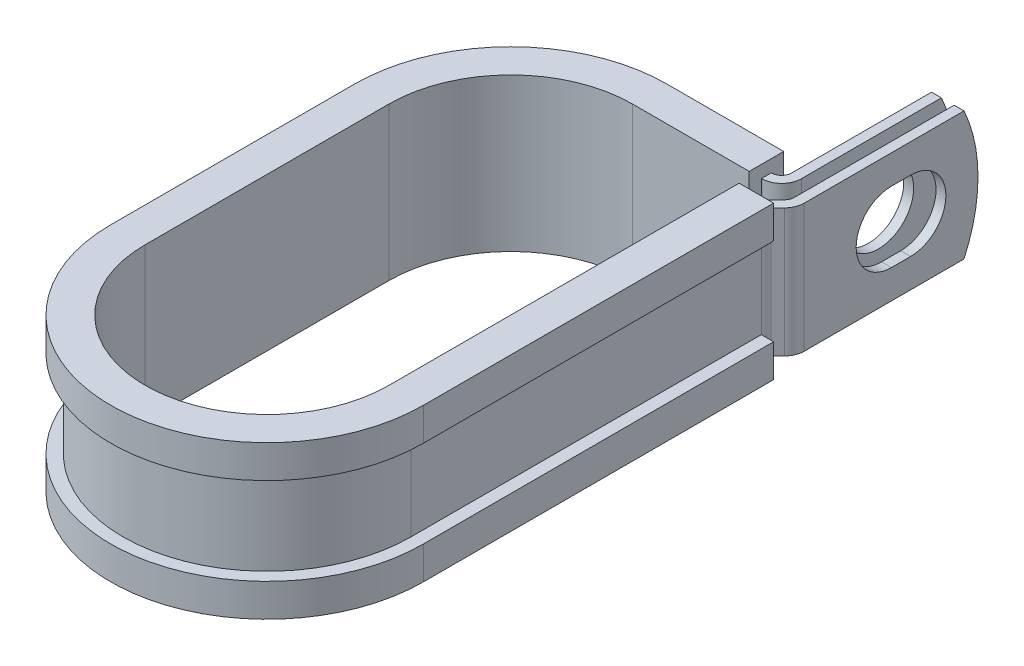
SolidWorks part; units mm, degrees
ref_plane "Front Plane" through (0, 0, 0) normal (0, 0, 1) x (1, 0, 0)
ref_plane "Top Plane" through (0, 0, 0) normal (0, 1, 0) x (1, 0, 0)
ref_plane "Right Plane" through (0, 0, 0) normal (1, 0, 0) x (0, 0, -1)
sketch "Sketch1" plane through (0, 0, 0) normal (0, 1, 0) x (1, 0, 0)
  line L0 (0, 16.5989) -> (14.4832, 16.5989)
  line L1 (16.5989, 0) -> (16.5989, 13.1864)
  line L2 (16.9216, 38.1) -> (16.9216, 19.0373)
  line L3 (17.3131, 14.9106) -> (18.1393, 15.7368)
  line L4 (-16.5989, 0) -> (-16.5989, -30.1498)
  line L5 (18.4964, 16.5989) -> (18.4964, 38.1)
  line L6 (16.5989, 0) -> (16.5989, -30.1498)
  arc A0 (0, 16.5989) -> (-16.5989, 0) centre (0, 0) ccw
  arc A1 (17.3131, 14.9106) -> (16.5989, 13.1864) centre (19.0373, 13.1864) ccw
  arc A2 (18.1393, 15.7368) -> (18.4964, 16.5989) centre (17.2772, 16.5989) ccw
  arc A3 (14.4832, 16.5989) -> (16.9216, 19.0373) centre (14.4832, 19.0373) ccw
  arc A4 (-16.5989, -30.1498) -> (16.5989, -30.1498) centre (0, -30.1498) ccw
extrude "Extrude-Thin1" add sketch "Sketch1" along normal mid plane 15.875 thin
sketch "Sketch2" plane through (15.7024, 0, 0) normal (-1, 0, 0) x (0, 0, 1)
  line L0 (-38.1, 7.9375) -> (-38.1, -7.9375) construction
  line L1 (0, 7.9375) -> (0, -7.9375) construction
  circle A0 centre (-28.575, 0) radius 4.3561
  point P2 (-38.1, 0)
extrude "Cut-Extrude1" cut sketch "Sketch2" against normal up to surface (1.2192 mm away)
sketch "Sketch3" plane through (19.7156, 0, 0) normal (1, 0, 0) x (0, 0, -1)
  line L0 (27.3812, 0) -> (29.7688, 0) construction
  line L1 (27.3812, 4.3561) -> (29.7688, 4.3561)
  line L2 (27.3812, -4.3561) -> (29.7688, -4.3561)
  line L3 (38.1, 7.9375) -> (38.1, -7.9375) construction
  arc A0 (27.3812, 4.3561) -> (27.3812, -4.3561) centre (27.3812, 0) ccw
  arc A1 (29.7688, -4.3561) -> (29.7688, 4.3561) centre (29.7688, 0) ccw
  point P3 (28.575, 0)
  point P8 (38.1, 0)
  point P11 (23.0251, 0)
  point P12 (34.1249, 0)
extrude "Cut-Extrude2" cut sketch "Sketch3" against normal up to surface (1.2192 mm away)
sketch "Sketch4" plane through (15.7024, 0, 0) normal (-1, 0, 0) x (0, 0, 1)
  line L0 (-38.1, 7.9375) -> (-38.1, -7.9375)
  line L1 (-38.1, 7.9375) -> (-36.3676, 7.9375)
  line L2 (-38.1, 7.9375) -> (-19.0373, 7.9375) construction
  line L3 (-38.1, -7.9375) -> (-36.3676, -7.9375)
  line L4 (-38.1, -7.9375) -> (-19.0373, -7.9375) construction
  arc A0 (-36.3676, 7.9375) -> (-36.3676, -7.9375) centre (-19.05, 0) ccw
extrude "Cut-Extrude3" cut sketch "Sketch4" against normal through all contours A0 M4 M5 | A0 L0 M2
ref_plane "Plane1" through (0, 0, -13.1864) normal (0, 0, -1) x (-1, 0, 0)
ref_plane "Plane2" through (14.4324, 0, 0) normal (-1, 0, 0) x (0, 0, 1)
sketch "Sketch5" plane through (0, 0, -13.1864) normal (0, 0, -1) x (-1, 0, 0)
  line L0 (-17.8181, 7.9375) -> (-16.5989, 7.9375)
  line L1 (-17.8181, 7.9375) -> (-17.8181, -7.9375) construction
  line L3 (-16.5989, 7.9375) -> (-16.5989, -7.9375)
  line L4 (-16.5989, -7.9375) -> (-17.8181, -7.9375)
  line L5 (-17.8181, -7.9375) -> (-17.8181, -5.3975)
  line L6 (-17.8181, 7.9375) -> (-17.8181, 5.3975)
  line L7 (-19.3421, 9.4615) -> (-19.3421, 5.3975)
  line L8 (-19.3421, 9.4615) -> (-15.0749, 9.4615)
  line L9 (-15.0749, 9.4615) -> (-15.0749, -9.4615)
  line L10 (-15.0749, -9.4615) -> (-19.3421, -9.4615)
  line L11 (-19.3421, -9.4615) -> (-19.3421, -5.3975)
  line L12 (-19.3421, 5.3975) -> (-17.8181, 5.3975)
  line L13 (-17.8181, -5.3975) -> (-19.3421, -5.3975)
sketch "Sketch6" plane through (0, 7.9375, 0) normal (0, 1, 0) x (1, 0, 0)
  line L0 (15.0749, 0) -> (15.0749, 13.1864)
  line L1 (15.0749, 13.1864) -> (19.3421, 13.1864) construction
  line L2 (14.4324, 6.9878) -> (14.4324, -6.9878) construction
  line L3 (15.0749, -30.1498) -> (15.0749, 0)
  line L4 (-15.0749, -30.1498) -> (-15.0749, 0)
  line L5 (0, 15.0749) -> (14.4324, 15.0749)
  arc A0 (0, 15.0749) -> (-15.0749, 0) centre (0, 0) ccw
  arc A1 (-15.0749, -30.1498) -> (15.0749, -30.1498) centre (0, -30.1498) ccw
sweep "Sweep1" add profiles "Sketch5" path "Sketch6"
equation "\"D4@Sketch5\" = \"D1@Extrude-Thin1\""
equation "\"D5@Sketch5\" = \"D5@Extrude-Thin1\""
equation "\"D1@Sketch3\" = \"D2@Sketch2\""
equation "\"D7@Sketch1\" = \"D3@Sketch2\" + \"D1@Sketch3\""
equation "\"D1@Sketch1\" = \"D1@Sketch6\" + 2 * \"D3@Sketch5\""
equation "\"D1@Sketch4\" = ( \"D1@Extrude-Thin1\" + .125 ) * 2"
equation "\"D9@Sketch1\"= \"D5@Extrude-Thin1\""
equation "\"D8@Sketch1\"= 2 * \"D5@Extrude-Thin1\""
equation "\"D2@Sketch1\" = 2 * \"D5@Extrude-Thin1\""
equation "\"D2@Sketch3\" = \"D1@Sketch2\""
equation "\"D6@Sketch1\" = \"D1@Sketch1\""
equation "\"D3@Sketch1\" = \"D1@Sketch6\""
